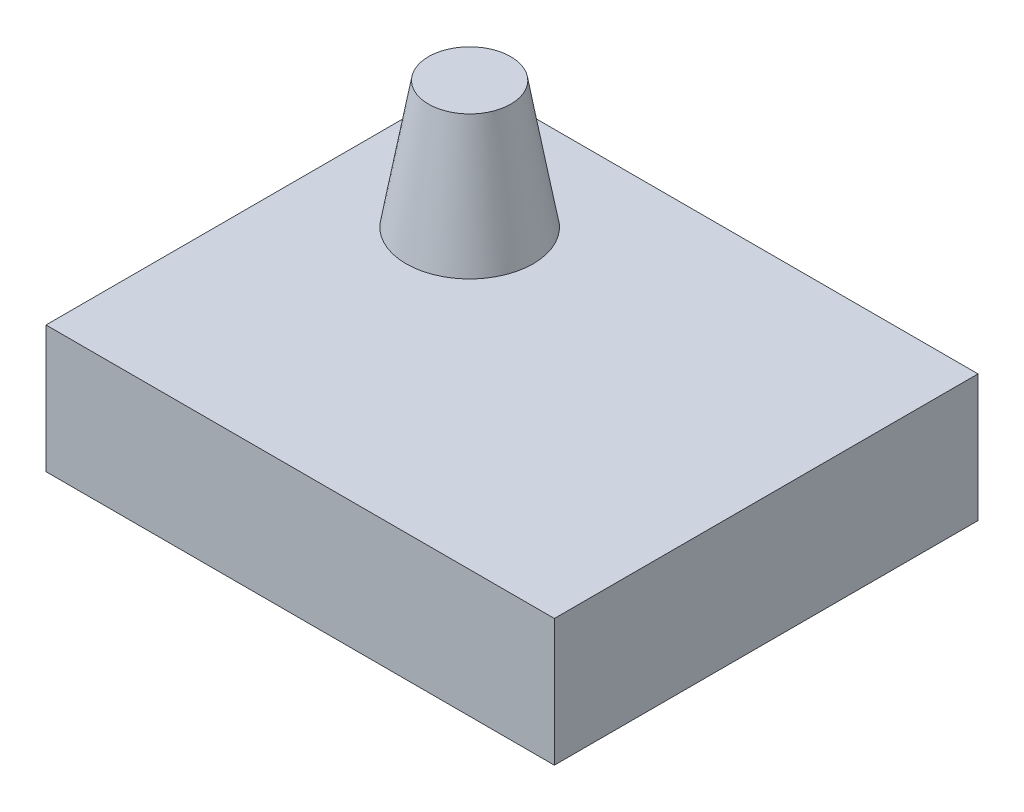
SolidWorks part; units mm, degrees
ref_plane "Alzado" through (0, 0, 0) normal (0, 0, 1) x (1, 0, 0)
ref_plane "Planta" through (0, 0, 0) normal (0, 1, 0) x (1, 0, 0)
ref_plane "Vista lateral" through (0, 0, 0) normal (1, 0, 0) x (0, 0, -1)
other "Centro de masa"
sketch "Base_rectandulo" plane through (0, 0, 0) normal (0, 1, 0) x (1, 0, 0)
  line L1 (60, 50) -> (-60, 50)
  line L2 (60, 50) -> (60, -50)
  line L3 (60, -50) -> (-60, -50)
  line L4 (-60, 50) -> (-60, -50)
  line L5 (60, 50) -> (-60, -50) construction
  line L6 (60, -50) -> (-60, 50) construction
  point P0 (0, 0)
  point P6 (0, 0)
  point P7 (0, 0)
extrude "ExtrusiónPrismaInferior" add sketch "Base_rectandulo" along normal blind 30
sketch "Base_tronco_cono" plane through (0, 30, 0) normal (0, 1, 0) x (1, 0, 0)
  line L0 (-60, 50) -> (-60, -50) construction
  line L1 (60, 50) -> (-60, 50) construction
  circle A0 centre (-30, 20) radius 15
  point P2 (0, 0)
  point P3 (0, 0)
  point P4 (0, 0)
  point P7 (0, 0)
  point P9 (-72.427, 13.1208)
extrude "Extrusión_tronco_cono" add sketch "Base_tronco_cono" along normal blind 30 draft 10 contours A0
equation "\"L_horizontal\"=120"
equation "\"Dimendion_horizontal@Base_rectandulo\" = \"L_horizontal\""
equation "\"L_vertical\"=100"
equation "\"D1@Base_rectandulo\" = \"L_vertical\""
equation "\"D_base\"=30"
equation "\"D1@Base_tronco_cono\" = \"D_base\""
